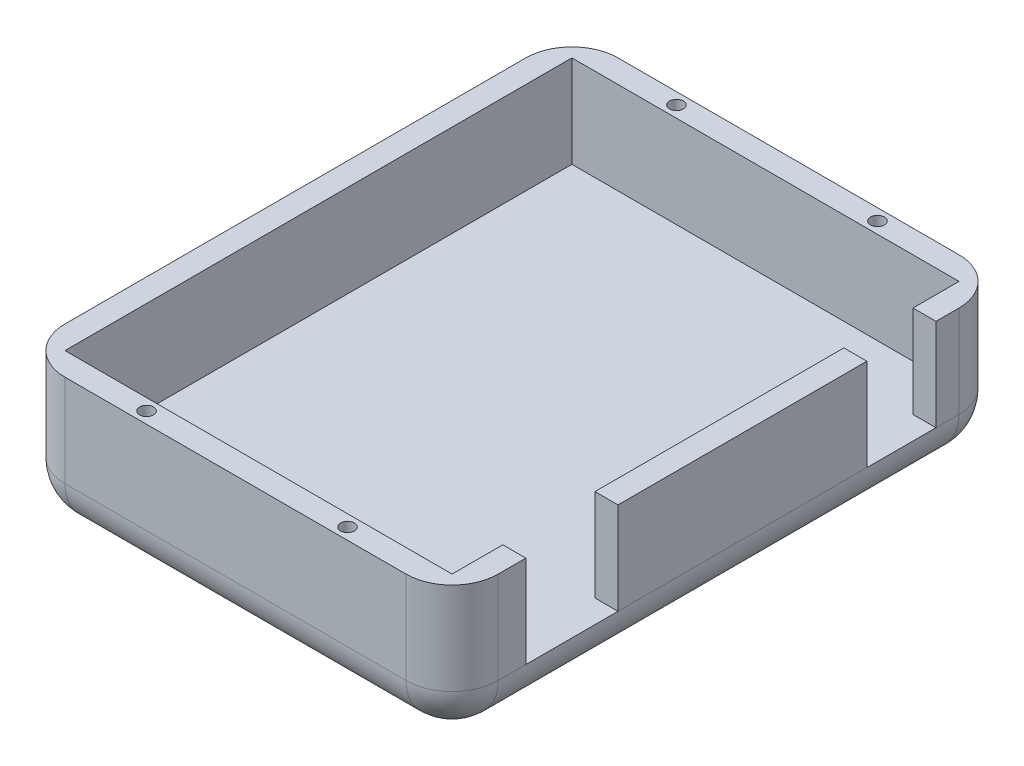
SolidWorks part; units mm, degrees
ref_plane "정면" through (0, 0, 0) normal (0, 0, 1) x (1, 0, 0)
ref_plane "윗면" through (0, 0, 0) normal (0, 1, 0) x (1, 0, 0)
ref_plane "우측면" through (0, 0, 0) normal (1, 0, 0) x (0, 0, -1)
sketch "스케치1" plane through (0, 0, 0) normal (0, 0, 1) x (1, 0, 0)
  line L0 (0, 0) -> (94, 0)
  line L1 (0, 0) -> (0, 30)
  line L2 (0, 30) -> (94, 30)
  line L3 (94, 30) -> (94, 0)
  dimension "D1" = 94
  dimension "D2" = 30
extrude "보스-돌출2" add sketch "스케치1" along normal blind 120 contours L2 L3 L0 L1
sketch "스케치2" plane through (0, 30, 0) normal (0, 1, 0) x (1, 0, 0)
  line L0 (47, 0) -> (47, -120) construction
  line L1 (0, 0) -> (94, 0) construction
  line L2 (0, -120) -> (94, -120) construction
  line L3 (0, -60) -> (94, -60) construction
  line L4 (0, -120) -> (0, 0) construction
  line L5 (94, -120) -> (94, 0) construction
  line L7 (5, -115) -> (89, -115)
  line L8 (5, -115) -> (5, -5)
  line L9 (5, -5) -> (89, -5)
  line L10 (89, -115) -> (89, -5)
  line L11 (47, -5) -> (47, -115) construction
  line L12 (5, -60) -> (89, -60) construction
  point P12 (47, -60)
  point P16 (0, 0)
  dimension "D1" = 84
  dimension "D2" = 110
extrude "컷-돌출1" cut sketch "스케치2" against normal blind 20 contours L9 L10 L7 L8
sketch "스케치4" plane through (0, 30, 0) normal (0, 1, 0) x (1, 0, 0)
  line L2 (89, -115) -> (89, -5) construction
  line L3 (0, -120) -> (0, 0) construction
  line L4 (89, -15) -> (100.6987, -15)
  line L5 (89, -15) -> (89, -27.228)
  line L6 (89, -27.228) -> (100.6987, -27.228)
  line L7 (100.6987, -15) -> (100.6987, -27.228)
  line L8 (0, -120) -> (94, -120) construction
  line L11 (89, -104) -> (101.8042, -104)
  line L12 (89, -104) -> (89, -84)
  line L13 (89, -84) -> (101.8042, -84)
  line L14 (101.8042, -104) -> (101.8042, -84)
  point P0 (0, 0)
  dimension "D1" = 94
  dimension "D2" = 94
  dimension "D3" = 100.6987
  dimension "D4" = 92.772
  dimension "D5" = 101.8042
  dimension "D6" = 20
  dimension "D7" = 16
  dimension "D8" = 105
  dimension "D9" = 120
extrude "컷-돌출5" cut sketch "스케치4" against normal blind 20 contours L13 L14 L11 L12
ref_plane "평면2" through (94, 30, 0) normal (1, 0, 0) x (0, 0, -1)
sketch "스케치9" plane through (0, 30, 0) normal (0, 1, 0) x (1, 0, 0)
  line L0 (0, -120) -> (0, 0) construction
  line L2 (89, -84) -> (89, -5) construction
  line L3 (0, -120) -> (94, -120) construction
  line L4 (89, -15) -> (106.0344, -15)
  line L5 (89, -15) -> (89, -30)
  line L6 (89, -30) -> (106.0344, -30)
  line L7 (106.0344, -15) -> (106.0344, -30)
  point P11 (0, 0)
  dimension "D1" = 94
  dimension "D2" = 15
  dimension "D3" = 106.0344
  dimension "D4" = 90
  dimension "D5" = 120
extrude "컷-돌출6" cut sketch "스케치9" against normal blind 20
sketch "스케치10" plane through (0, 0, 0) normal (0, -1, 0) x (-1, 0, 0)
  line L0 (-94, -120) -> (-60, -76.8831)
  line L2 (0, 0) -> (-94, 0) construction
  line L3 (-60, -42.8831) -> (-94, 0)
  line L4 (-34, -76.8831) -> (0, -120)
  line L5 (-34, -42.8831) -> (0, 0)
  line L7 (-34, -42.8831) -> (-60, -42.8831)
  line L8 (-34, -42.8831) -> (-34, -76.8831)
  line L9 (-34, -76.8831) -> (-60, -76.8831)
  line L10 (-60, -42.8831) -> (-60, -76.8831)
  point P12 (-47, -60)
  dimension "D1" = 26
  dimension "D2" = 42.8831
  dimension "D4" = 34
extrude "돌출-얇게2" add sketch "스케치10" along normal blind 26 thin contours L9
ref_plane "평면3" through (0, 0, 0) normal (1, 0, 0) x (0, 0, -1)
sketch "스케치16" plane through (0, 0, 42.8831) normal (0, 0, -1) x (-1, 0, 0)
  line L0 (-60, -13) -> (-34, -13) construction
  line L1 (-60, -26) -> (-60, 0) construction
  line L2 (-34, -26) -> (-34, 0) construction
  line L3 (-47, 0) -> (-47, -26) construction
  line L4 (-34, 0) -> (-60, 0) construction
  line L5 (-34, -26) -> (-60, -26) construction
  circle A0 centre (-47, -13) radius 11.5
  dimension "D1" = 23
extrude "컷-돌출8" cut sketch "스케치16" against normal through all contours A0
sketch "스케치17" plane through (0, 0, 76.8831) normal (0, 0, 1) x (1, 0, 0)
  line L0 (47, 0) -> (47, -26) construction
  line L1 (0, 0) -> (94, 0) construction
  line L2 (34, -26) -> (60, -26) construction
  line L3 (34, -13) -> (60, -13) construction
  line L4 (34, -26) -> (34, 0) construction
  line L5 (60, -26) -> (60, 0) construction
  circle A0 centre (47, -13) radius 13
sketch "스케치19" plane through (0, 0, 0) normal (0, 0, 1) x (1, 0, 0)
  line L0 (34, -13) -> (34, -26)
  line L1 (34, -26) -> (60, -26)
  line L2 (60, -26) -> (60, -13)
  line L3 (34, -13) -> (60, -13) construction
  arc A0 (34, -13) -> (60, -13) centre (47, -13) ccw
extrude "컷-돌출10" cut sketch "스케치19" along normal through all contours A0 L1 L2 | A0 L0 L1
fillet "필렛2" radius 10 1 edges at (0, 15, 0)
fillet "필렛3" radius 10 3 edges at (0, 15, 120) (94, 15, 120) (94, 15, 0)
fillet "필렛4" radius 10 8 edges at (2.9289, 0, 2.9289) (0, 0, 60) (2.9289, 0, 117.0711) (47, 0, 120) (91.0711, 0, 117.0711) (94, 0, 60) (91.0711, 0, 2.9289) (47, 0, 0)
sketch "스케치20" plane through (0, 30, 0) normal (0, 1, 0) x (1, 0, 0)
  line L0 (0, -110) -> (0, -10) construction
  circle A0 centre (25.1928, -2.5) radius 1.5
  circle A1 centre (68.8072, -2.5) radius 1.5
  circle A2 centre (25.1928, -117.5) radius 1.5
  circle A3 centre (68.8072, -117.5) radius 1.5
  dimension "D1" = 3
  dimension "D2" = 3
  dimension "D3" = 25.1928
  dimension "D4" = 68.8072
  dimension "D5" = 105
  dimension "D6" = 112.5
  dimension "D7" = 2.5
extrude "컷-돌출12" cut sketch "스케치20" against normal blind 10 contours A0 | A2 | A3 | A1
